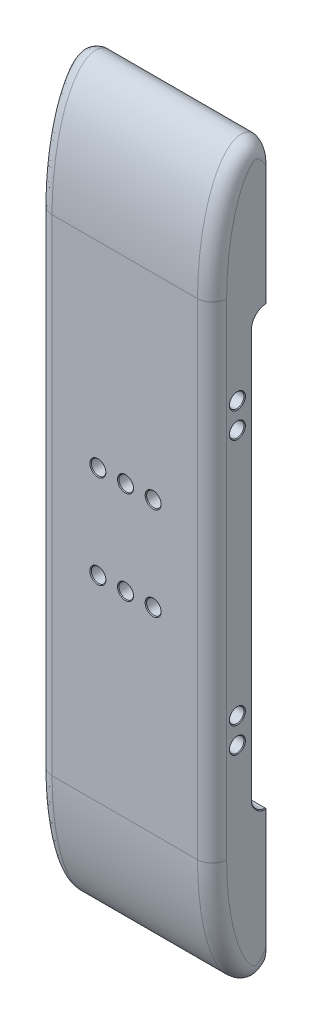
SolidWorks part; units mm, degrees
ref_plane "Спереди" through (0, 0, 0) normal (0, 0, 1) x (1, 0, 0)
ref_plane "Сверху" through (0, 0, 0) normal (0, 1, 0) x (1, 0, 0)
ref_plane "Справа" through (0, 0, 0) normal (1, 0, 0) x (0, 0, -1)
sketch "Эскиз1" plane through (0, 0, 0) normal (1, 0, 0) x (0, 0, -1)
  line L0 (0, 250) -> (0, -250) construction
  line L1 (0, 0) -> (-37.53, 0) construction
  line L2 (-10, 140) -> (-10, -140)
  line L3 (-7.53, 167) -> (-37.53, 167) construction
  line L4 (0, 150) -> (0, 247.3429)
  line L5 (0, -150) -> (0, -247.3429)
  line L6 (-37.53, -167) -> (-37.53, 167)
  arc A0 (0, 150) -> (-10, 140) centre (0, 140) ccw
  arc A1 (0, -150) -> (-10, -140) centre (0, -140) cw
  ellipse E0 centre (-7.53, 167) end of major axis (-7.53, 250) minor radius 30 (0, 247.3429) -> (-37.53, 167) ccw
  ellipse E1 centre (-7.53, -167) end of major axis (-7.53, -250) minor radius 30 (0, -247.3429) -> (-37.53, -167) cw
  dimension "D2" = 20
  dimension "D1" = 500
  dimension "D3" = 280
  dimension "D4" = 37.53
  dimension "D5" = 83
  dimension "D6" = 30
extrude "Бобышка-Вытянуть1" add sketch "Эскиз1" along normal mid plane 120
fillet "Скругление1" radius 10 6 edges at (-60, 232.6435, 25.8889) (-60, -232.6435, 25.8889) (60, -232.6435, 25.8889) (60, 0, 37.53) (-60, 0, 37.53) (60, 232.6435, 25.8889)
sketch "Эскиз2" plane through (0, 0, 37.53) normal (0, 0, 1) x (1, 0, 0)
  line L0 (-18.5, 32) -> (0.5, 32) construction
  line L1 (0.5, 32) -> (19.5, 32) construction
  line L2 (-50, 0) -> (50, 0) construction
  line L3 (-50, 167) -> (-50, -167) construction
  line L4 (50, -167) -> (50, 167) construction
  line L5 (0.5, -32) -> (19.5, -32) construction
  line L6 (-18.5, -32) -> (0.5, -32) construction
  line L8 (60, 167) -> (60, -167) construction
  circle A0 centre (0.5, 32) radius 5
  circle A1 centre (19.5, 32) radius 5
  circle A2 centre (-18.5, 32) radius 5
  circle A3 centre (-18.5, -32) radius 5
  circle A4 centre (19.5, -32) radius 5
  circle A5 centre (0.5, -32) radius 5
  dimension "D4" = 10
  dimension "D1" = 19
  dimension "D2" = 64
  dimension "D3" = 40.5
extrude "Вырез-Вытянуть1" cut sketch "Эскиз2" against normal blind 20
sketch "Эскиз3" plane through (60, 0, 0) normal (1, 0, 0) x (0, 0, -1)
  line L0 (0, 0) -> (-27.53, 0) construction
  line L1 (-27.53, 167) -> (-27.53, -167) construction
  line L2 (-10, -140) -> (-10, 140) construction
  circle A0 centre (-20.11, 102.5) radius 5
  circle A1 centre (-20.11, 85) radius 5
  circle A2 centre (-20.11, -85) radius 5
  circle A3 centre (-20.11, -102.5) radius 5
  dimension "D2" = 10
  dimension "D1" = 17.5
  dimension "D3" = 10.11
  dimension "D4" = 170
extrude "Вырез-Вытянуть2" cut sketch "Эскиз3" against normal blind 30
chamfer "Фаска1" distance 0.5 angle 45 38 edges at (0, 150, 0) (60, 190.9371, 0) (55.2395, 245.4768, 0) (0, 247.3429, 0) (-57.5187, 242.903, 0) (-60, 190.9371, 0) (14.5, -32, 37.53) (14.5, -32, 17.53) (-4.5, -32, 37.53) (-4.5, -32, 17.53) (-23.5, -32, 37.53) (-23.5, -32, 17.53) (24.5, 32, 37.53) (24.5, 32, 17.53) (5.5, 32, 37.53) (5.5, 32, 17.53) (-13.5, 32, 37.53) (-13.5, 32, 17.53) (60, 102.5, 15.11) (30, 102.5, 15.11) (60, 85, 15.11) (30, 85, 15.11) (60, -85, 25.11) (30, -85, 25.11) (60, -102.5, 25.11) (30, -102.5, 25.11) (-60, -190.9371, 0) (-55.2395, -245.4768, 0) (0, -247.3429, 0) (57.5187, -242.903, 0) (0, -150, 0) (60, -190.9371, 0) (-60, -147.0711, 7.0711) (-60, 147.0711, 7.0711) (-60, 0, 10) (60, -147.0711, 7.0711) (60, 147.0711, 7.0711) (60, 0, 10)
sketch "Эскиз4" plane through (0, 0, 0) normal (0, 0, 1) x (1, 0, 0)
  line L0 (50, 250) -> (-50, 250) construction
  line L1 (0, 0) -> (60, 0) construction
  line L2 (60, 167) -> (60, -167) construction
  circle A0 centre (0, 190) radius 21
  circle A1 centre (0, -190) radius 21
  dimension "D1" = 42
  dimension "D2" = 60
